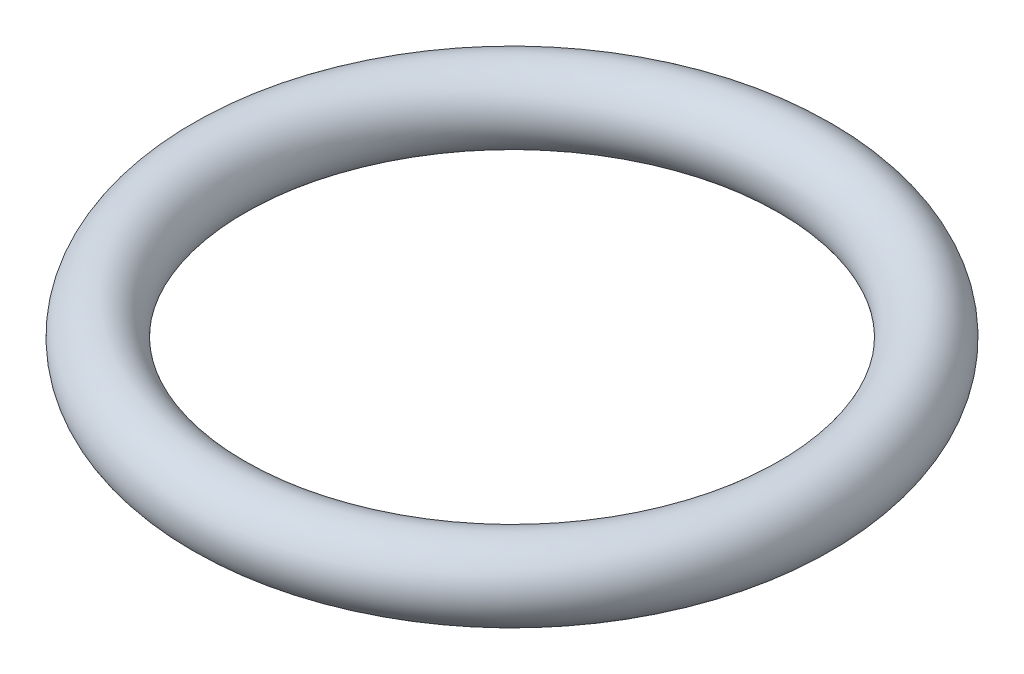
SolidWorks part; units mm, degrees
ref_plane "Face" through (0, 0, 0) normal (0, 0, 1) x (1, 0, 0)
ref_plane "Dessus" through (0, 0, 0) normal (0, 1, 0) x (1, 0, 0)
ref_plane "Côté" through (0, 0, 0) normal (1, 0, 0) x (0, 0, -1)
sketch "Esquisse1" plane through (0, 0, 0) normal (0, 0, 1) x (1, 0, 0)
  line L0 (0, 0) -> (0, 15.7513) construction
  line L1 (0, 0) -> (-8.3073, 0) construction
  circle A0 centre (-12, 1.5) radius 1.5
  dimension "D1" = 3
  dimension "D2" = 21
revolve "Base-Révolution" add sketch "Esquisse1" angle 360 about L0
sketch "Esquisse2" plane through (0, 0, 0) normal (0, 1, 0) x (1, 0, 0)
  circle A0 centre (0, 0) radius 6.75
  dimension "D1" = 13.5
extrude "Tronquage exter" [suppressed] cut sketch "Esquisse2" along normal through all flip side to cut
sketch "Esquisse3" [suppressed] plane through (0, 0, 0) normal (0, 0, 1) x (1, 0, 0)
  line L0 (13.5, 5.2656) -> (13.5, -2.2033)
  line L1 (0, -1.4253) -> (0, 4.332) construction
